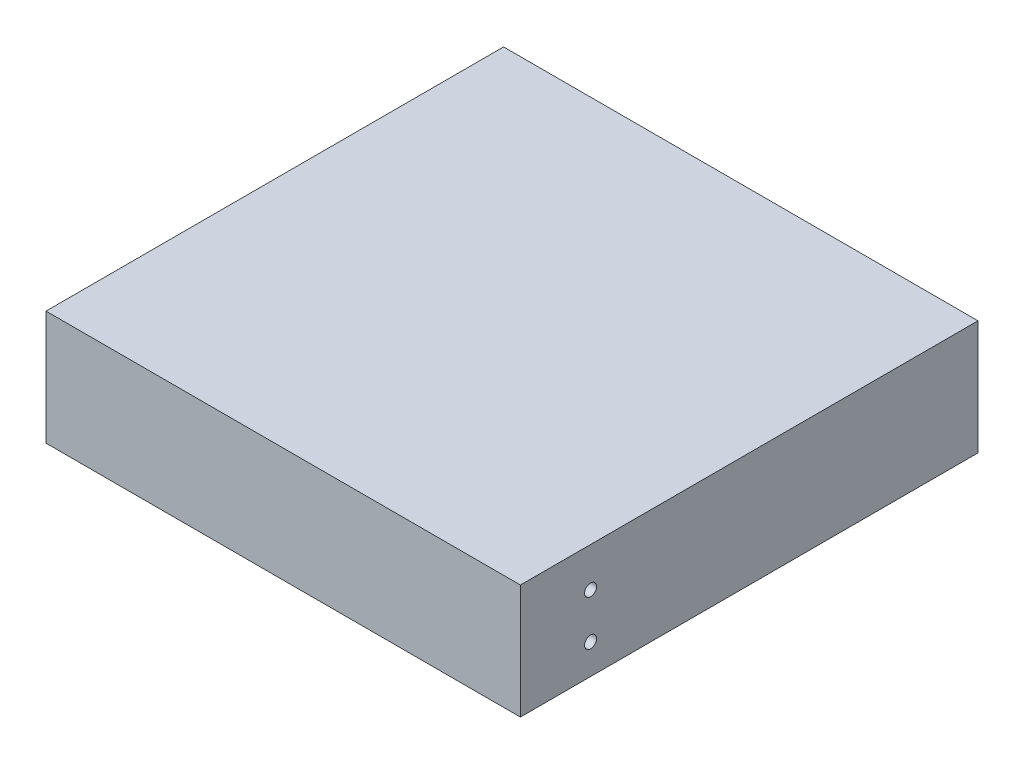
SolidWorks part; units mm, degrees
ref_plane "Front Plane" through (0, 0, 0) normal (0, 0, 1) x (1, 0, 0)
ref_plane "Top Plane" through (0, 0, 0) normal (0, 1, 0) x (1, 0, 0)
ref_plane "Right Plane" through (0, 0, 0) normal (1, 0, 0) x (0, 0, -1)
sketch "Sketch2" plane through (0, 0, 0) normal (1, 0, 0) x (0, 0, -1)
  line L1 (0, 0) -> (304.8, 0)
  line L2 (0, 0) -> (0, 76.2)
  line L3 (0, 76.2) -> (304.8, 76.2)
  line L4 (304.8, 0) -> (304.8, 76.2)
  dimension "D1" = 304.8
  dimension "D2" = 76.2
extrude "Extrude1" add sketch "Sketch2" against normal blind 316
sketch "Sketch3" plane through (0, 0, 0) normal (1, 0, 0) x (0, 0, -1)
  line L0 (0, 76.2) -> (0, 0) construction
  line L1 (0, 0) -> (304.8, 0) construction
  circle A0 centre (46.7212, 20) radius 4
  dimension "D1" = 8
  dimension "D2" = 46.7212
  dimension "D3" = 20
extrude "Cut-Extrude1" cut sketch "Sketch3" against normal blind 20
pattern_linear "LPattern1" count 2 spacing 30 along (0, 1, 0) of "Cut-Extrude1"
